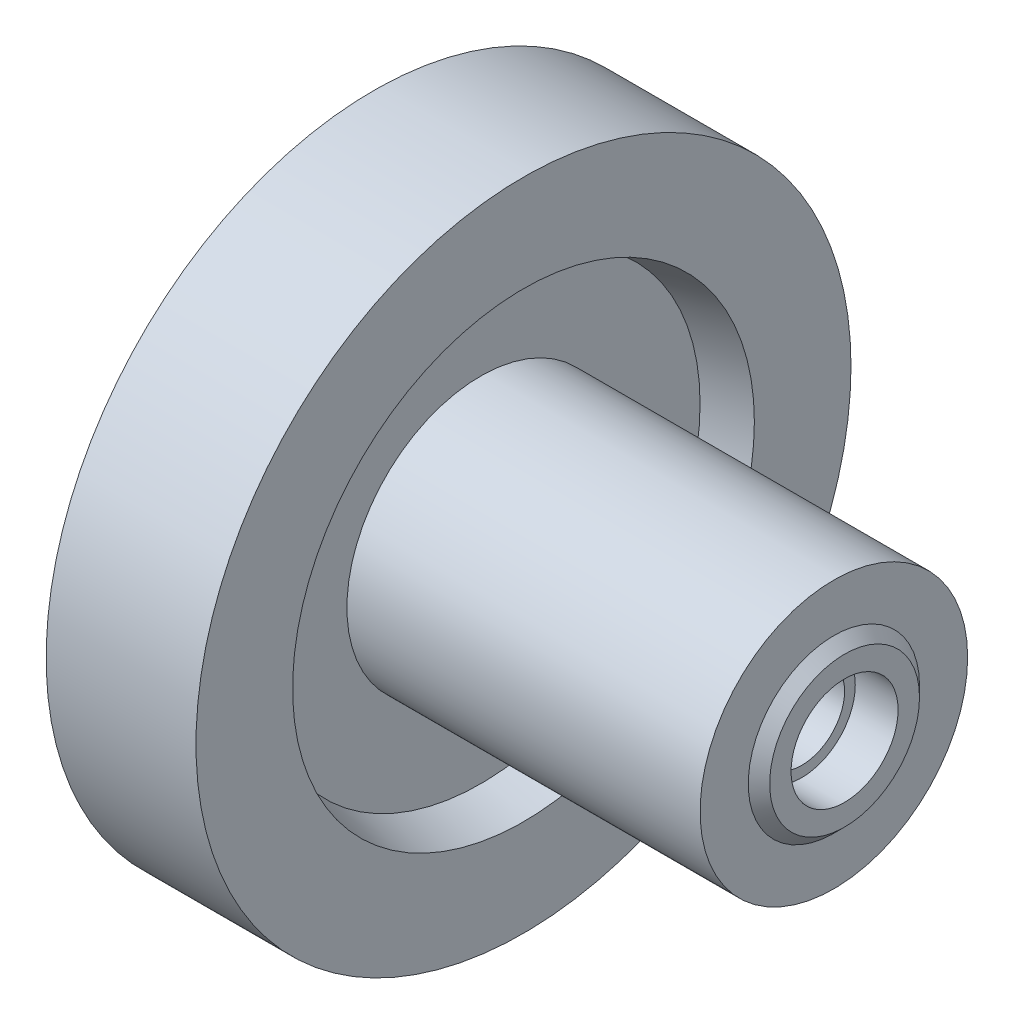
SolidWorks part; units mm, degrees
ref_plane "Plan1" through (0, 0, 0) normal (0, 0, 1) x (1, 0, 0)
ref_plane "Plan2" through (0, 0, 0) normal (0, 1, 0) x (1, 0, 0)
ref_plane "Plan3" through (0, 0, 0) normal (1, 0, 0) x (0, 0, -1)
sketch "Esquisse1" plane through (0, 0, 0) normal (0, 0, 1) x (1, 0, 0)
  line L0 (-19.6687, 0) -> (-103.1531, 0) construction
  line L1 (-50.2, 2) -> (-70, 2)
  line L2 (-50.2, 2) -> (-50.2, 2.5)
  line L3 (-50.2, 2.5) -> (-48.2, 2.5)
  line L4 (-48.2, 2.5) -> (-48.2, 3.5)
  line L5 (-48.2, 3.5) -> (-48.6999, 3.9999)
  line L6 (-48.6999, 3.9999) -> (-48.6999, 6.25)
  line L7 (-48.6999, 6.25) -> (-65.1999, 6.25)
  line L8 (-65.1999, 6.25) -> (-65.1999, 10.25)
  line L9 (-65.1999, 10.25) -> (-63.1999, 10.7859)
  line L10 (-63.1999, 10.7859) -> (-63.1999, 15.3)
  line L12 (-70.1999, 15.3) -> (-70.1999, 10.7859)
  line L13 (-70.1999, 10.7859) -> (-68.1999, 10.25)
  line L14 (-68.1999, 10.25) -> (-68.1999, 3.38)
  line L15 (-68.1999, 3.38) -> (-70, 3.38)
  line L16 (-70, 3.38) -> (-70, 2)
  line L17 (-63.1999, 15.3) -> (-70.1999, 15.3)
  dimension "D1" = 2
  dimension "D2" = 19.8
  dimension "D3" = 0.5
  dimension "D4" = 2
  dimension "D5" = 1
  dimension "D6" = 45
  dimension "D7" = 0.4999
  dimension "D8" = 6.25
  dimension "D9" = 16.5
  dimension "D10" = 15
  dimension "D11" = 4
  dimension "D12" = 2
  dimension "D13" = 15.3
  dimension "D16" = 2
  dimension "D17" = 15
  dimension "D18" = 6.87
revolve "Base-Révolution" add sketch "Esquisse1" angle 360 about L0
